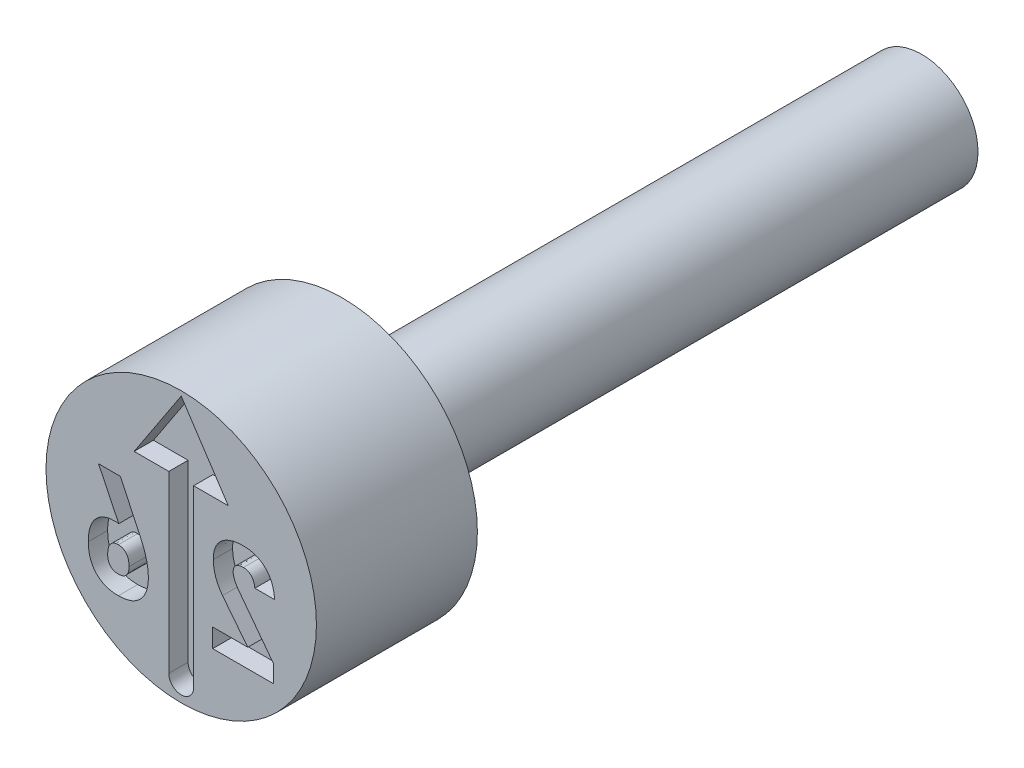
SolidWorks part; units mm, degrees
ref_plane "Front Plane" through (0, 0, 0) normal (0, 0, 1) x (1, 0, 0)
ref_plane "Top Plane" through (0, 0, 0) normal (0, 1, 0) x (1, 0, 0)
ref_plane "Right Plane" through (0, 0, 0) normal (1, 0, 0) x (0, 0, -1)
sketch "Sketch2" plane through (0, 0, 0) normal (1, 0, 0) x (0, 0, -1)
  line L0 (0.4039, 0) -> (50000.4039, 0) construction
  line L6 (0, 4.2) -> (0, 0)
  line L7 (5, 4.2) -> (0, 4.2)
  line L8 (5, 1.75) -> (5, 4.2)
  line L9 (23, 1.75) -> (5, 1.75)
  line L10 (23, 0) -> (23, 1.75)
  line L11 (0, 0) -> (23, 0)
  dimension "D1" = 8.4
  dimension "D2" = 3.5
  dimension "D3" = 23
  dimension "D4" = 5
revolve "Revolve1" add sketch "Sketch2" angle 360 about L0
sketch "Sketch3" plane through (0, 0, 0) normal (0, 0, 1) x (1, 0, 0)
  line L0 (0, 0) -> (0, 202500) construction
  line L1 (0.3857, 1.8354) -> (0.3857, -3.5967)
  line L2 (1.4619, 1.8354) -> (0.3857, 1.8354)
  line L3 (0, 4.0543) -> (1.4619, 1.8354)
  line L15 (0, 4.0543) -> (-1.4619, 1.8354)
  line L16 (-1.4619, 1.8354) -> (-0.3857, 1.8354)
  line L17 (-0.3857, 1.8354) -> (-0.3857, -3.5967)
  arc A2 (-0.3857, -3.5967) -> (0.3857, -3.5967) centre (0, -3.5967) ccw
extrude "Cut-Extrude4" cut sketch "Sketch3" against normal blind 0.6
sketch "Sketch4" plane through (0, 0, 0) normal (0, 0, 1) x (1, 0, 0)
  text T0 "2  6" font "Bahnschrift" height 3.2
  dimension "D1" = 2.25
  dimension "D2" = 3.1
extrude "Cut-Extrude5" cut sketch "Sketch4" against normal blind 0.6
